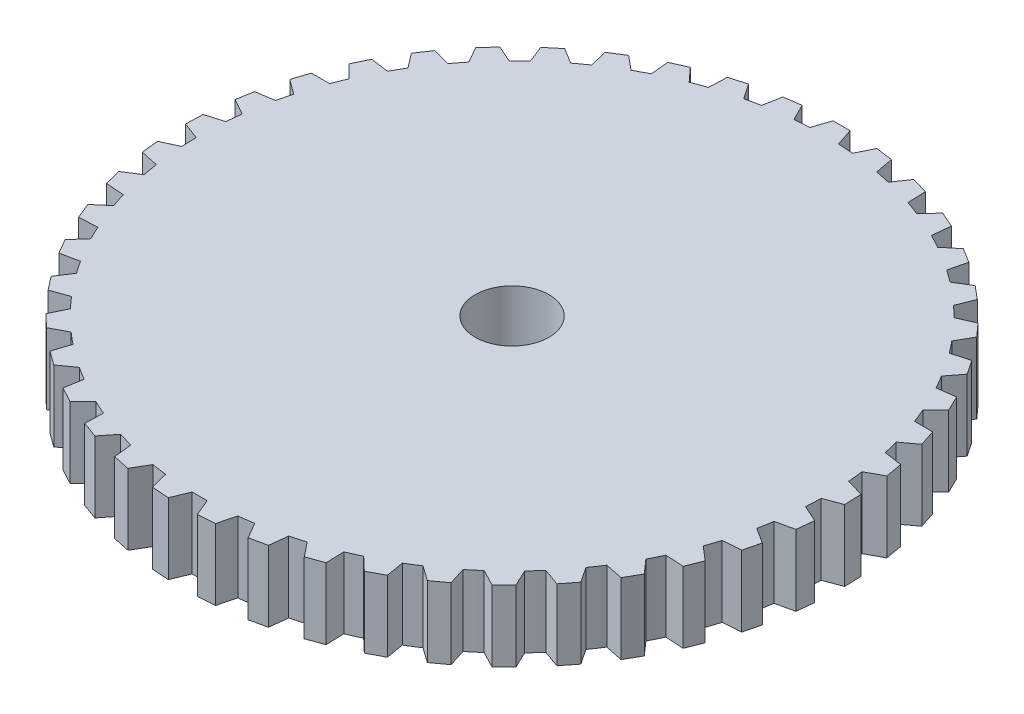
SolidWorks part; units mm, degrees
ref_plane "Front Plane" through (0, 0, 0) normal (0, 0, 1) x (1, 0, 0)
ref_plane "Top Plane" through (0, 0, 0) normal (0, 1, 0) x (1, 0, 0)
ref_plane "Right Plane" through (0, 0, 0) normal (1, 0, 0) x (0, 0, -1)
sketch "Sketch1" plane through (0, 0, 0) normal (0, 1, 0) x (1, 0, 0)
  circle A0 centre (0, 0) radius 13.97
extrude "Boss-Extrude1" add sketch "Sketch1" along normal blind 3.175
sketch "Sketch2" plane through (0, 3.175, 0) normal (0, 1, 0) x (1, 0, 0)
  line L0 (1.673, 14.6417) -> (2.4276, 14.5356)
  line L1 (-0.762, 13.589) -> (0.762, 13.589)
  line L2 (2.4276, 14.5356) -> (2.6458, 13.3507)
  line L3 (-0.381, 14.732) -> (0.381, 14.732)
  line L4 (0.381, 14.732) -> (0.762, 13.589)
  line L5 (-0.381, 14.732) -> (-0.762, 13.589)
  line L6 (1.1366, 13.5628) -> (2.6458, 13.3507)
  line L7 (1.673, 14.6417) -> (1.1366, 13.5628)
  line L8 (3.6944, 14.2663) -> (4.4269, 14.0563)
  line L9 (4.4269, 14.0563) -> (4.4781, 12.8525)
  line L10 (3.0132, 13.2726) -> (4.4781, 12.8525)
  line L11 (3.6944, 14.2663) -> (3.0132, 13.2726)
  line L12 (5.644, 13.6133) -> (6.3401, 13.3034)
  line L13 (6.3401, 13.3034) -> (6.2233, 12.1042)
  line L14 (4.831, 12.7241) -> (6.2233, 12.1042)
  line L15 (5.644, 13.6133) -> (4.831, 12.7241)
  line L16 (7.4837, 12.6953) -> (8.1299, 12.2915)
  line L17 (8.1299, 12.2915) -> (7.8473, 11.1203)
  line L18 (6.5549, 11.9279) -> (7.8473, 11.1203)
  line L19 (7.4837, 12.6953) -> (6.5549, 11.9279)
  line L20 (9.1777, 11.5303) -> (9.7614, 11.0405)
  line L21 (9.7614, 11.0405) -> (9.3186, 9.92)
  line L22 (8.1511, 10.8996) -> (9.3186, 9.92)
  line L23 (9.1777, 11.5303) -> (8.1511, 10.8996)
  line L24 (10.6931, 10.1408) -> (11.2029, 9.5745)
  line L25 (11.2029, 9.5745) -> (10.6085, 8.5265)
  line L26 (9.5887, 9.6591) -> (10.6085, 8.5265)
  line L27 (10.6931, 10.1408) -> (9.5887, 9.6591)
  line L28 (12.0003, 8.5539) -> (12.4264, 7.9222)
  line L29 (12.4264, 7.9222) -> (11.6919, 6.9671)
  line L30 (10.8397, 8.2306) -> (11.6919, 6.9671)
  line L31 (12.0003, 8.5539) -> (10.8397, 8.2306)
  line L32 (13.074, 6.8005) -> (13.4081, 6.1156)
  line L33 (13.4081, 6.1156) -> (12.5478, 5.2721)
  line L34 (11.8797, 6.6419) -> (12.5478, 5.2721)
  line L35 (13.074, 6.8005) -> (11.8797, 6.6419)
  line L36 (13.8932, 4.9148) -> (14.1287, 4.1901)
  line L37 (14.1287, 4.1901) -> (13.1594, 3.4745)
  line L38 (12.6884, 4.9239) -> (13.1594, 3.4745)
  line L39 (13.8932, 4.9148) -> (12.6884, 4.9239)
  line L40 (14.442, 2.9334) -> (14.5743, 2.183)
  line L41 (14.5743, 2.183) -> (13.5149, 1.6093)
  line L42 (13.2502, 3.1101) -> (13.5149, 1.6093)
  line L43 (14.442, 2.9334) -> (13.2502, 3.1101)
  line L44 (14.7097, 0.8949) -> (14.7363, 0.1334)
  line L45 (14.7363, 0.1334) -> (13.6073, -0.2873)
  line L46 (13.5541, 1.2358) -> (13.6073, -0.2873)
  line L47 (14.7097, 0.8949) -> (13.5541, 1.2358)
  line L48 (14.6911, -1.161) -> (14.6115, -1.9188)
  line L49 (14.6115, -1.9188) -> (13.4349, -2.1783)
  line L50 (13.5942, -0.6626) -> (13.4349, -2.1783)
  line L51 (14.6911, -1.161) -> (13.5942, -0.6626)
  line L52 (14.3866, -3.1943) -> (14.2022, -3.9337)
  line L53 (14.2022, -3.9337) -> (13.001, -4.0268)
  line L54 (13.3697, -2.5481) -> (13.001, -4.0268)
  line L55 (14.3866, -3.1943) -> (13.3697, -2.5481)
  line L56 (13.802, -5.1654) -> (13.5165, -5.872)
  line L57 (13.5165, -5.872) -> (12.3141, -5.797)
  line L58 (12.885, -4.384) -> (12.3141, -5.797)
  line L59 (13.802, -5.1654) -> (12.885, -4.384)
  line L60 (12.9488, -7.036) -> (12.5678, -7.696)
  line L61 (12.5678, -7.696) -> (11.3874, -7.4544)
  line L62 (12.1494, -6.1346) -> (11.3874, -7.4544)
  line L63 (12.9488, -7.036) -> (12.1494, -6.1346)
  line L64 (11.8435, -8.7697) -> (11.3744, -9.3702)
  line L65 (11.3744, -9.3702) -> (10.2391, -8.9667)
  line L66 (11.1774, -7.7658) -> (10.2391, -8.9667)
  line L67 (11.8435, -8.7697) -> (11.1774, -7.7658)
  line L68 (10.5078, -10.3326) -> (9.9596, -10.862)
  line L69 (9.9596, -10.862) -> (8.8916, -10.3044)
  line L70 (9.9878, -9.2458) -> (8.8916, -10.3044)
  line L71 (10.5078, -10.3326) -> (9.9878, -9.2458)
  line L72 (8.9675, -11.6945) -> (8.351, -12.1424)
  line L73 (8.351, -12.1424) -> (7.3709, -11.4416)
  line L74 (8.6039, -10.5458) -> (7.3709, -11.4416)
  line L75 (8.9675, -11.6945) -> (8.6039, -10.5458)
  line L76 (7.2527, -12.8287) -> (6.5799, -13.1865)
  line L77 (6.5799, -13.1865) -> (5.7068, -12.3561)
  line L78 (7.0525, -11.6406) -> (5.7068, -12.3561)
  line L79 (7.2527, -12.8287) -> (7.0525, -11.6406)
  line L80 (5.3967, -13.7132) -> (4.6806, -13.9739)
  line L81 (4.6806, -13.9739) -> (3.9317, -13.0301)
  line L82 (5.3638, -12.5089) -> (3.9317, -13.0301)
  line L83 (5.3967, -13.7132) -> (5.3638, -12.5089)
  line L84 (3.4356, -14.3309) -> (2.6903, -14.4893)
  line L85 (2.6903, -14.4893) -> (2.08, -13.4505)
  line L86 (3.5707, -13.1336) -> (2.08, -13.4505)
  line L87 (3.4356, -14.3309) -> (3.5707, -13.1336)
  line L88 (1.4077, -14.6695) -> (0.6476, -14.7227)
  line L89 (0.6476, -14.7227) -> (0.1878, -13.6091)
  line L90 (1.7081, -13.5027) -> (0.1878, -13.6091)
  line L91 (1.4077, -14.6695) -> (1.7081, -13.5027)
  line L92 (-0.6476, -14.7227) -> (-1.4077, -14.6695)
  line L93 (-1.4077, -14.6695) -> (-1.7081, -13.5027)
  line L94 (-0.1878, -13.6091) -> (-1.7081, -13.5027)
  line L95 (-0.6476, -14.7227) -> (-0.1878, -13.6091)
  line L96 (-2.6903, -14.4893) -> (-3.4356, -14.3309)
  line L97 (-3.4356, -14.3309) -> (-3.5707, -13.1336)
  line L98 (-2.08, -13.4505) -> (-3.5707, -13.1336)
  line L99 (-2.6903, -14.4893) -> (-2.08, -13.4505)
  line L100 (-4.6806, -13.9739) -> (-5.3967, -13.7132)
  line L101 (-5.3967, -13.7132) -> (-5.3638, -12.5089)
  line L102 (-3.9317, -13.0301) -> (-5.3638, -12.5089)
  line L103 (-4.6806, -13.9739) -> (-3.9317, -13.0301)
  line L104 (-6.5799, -13.1865) -> (-7.2527, -12.8287)
  line L105 (-7.2527, -12.8287) -> (-7.0525, -11.6406)
  line L106 (-5.7068, -12.3561) -> (-7.0525, -11.6406)
  line L107 (-6.5799, -13.1865) -> (-5.7068, -12.3561)
  line L108 (-8.351, -12.1424) -> (-8.9675, -11.6945)
  line L109 (-8.9675, -11.6945) -> (-8.6039, -10.5458)
  line L110 (-7.3709, -11.4416) -> (-8.6039, -10.5458)
  line L111 (-8.351, -12.1424) -> (-7.3709, -11.4416)
  line L112 (-9.9596, -10.862) -> (-10.5078, -10.3326)
  line L113 (-10.5078, -10.3326) -> (-9.9878, -9.2458)
  line L114 (-8.8916, -10.3044) -> (-9.9878, -9.2458)
  line L115 (-9.9596, -10.862) -> (-8.8916, -10.3044)
  line L116 (-11.3744, -9.3702) -> (-11.8435, -8.7697)
  line L117 (-11.8435, -8.7697) -> (-11.1774, -7.7658)
  line L118 (-10.2391, -8.9667) -> (-11.1774, -7.7658)
  line L119 (-11.3744, -9.3702) -> (-10.2391, -8.9667)
  line L120 (-12.5678, -7.696) -> (-12.9488, -7.036)
  line L121 (-12.9488, -7.036) -> (-12.1494, -6.1346)
  line L122 (-11.3874, -7.4544) -> (-12.1494, -6.1346)
  line L123 (-12.5678, -7.696) -> (-11.3874, -7.4544)
  line L124 (-13.5165, -5.872) -> (-13.802, -5.1654)
  line L125 (-13.802, -5.1654) -> (-12.885, -4.384)
  line L126 (-12.3141, -5.797) -> (-12.885, -4.384)
  line L127 (-13.5165, -5.872) -> (-12.3141, -5.797)
  line L128 (-14.2022, -3.9337) -> (-14.3866, -3.1943)
  line L129 (-14.3866, -3.1943) -> (-13.3697, -2.5481)
  line L130 (-13.001, -4.0268) -> (-13.3697, -2.5481)
  line L131 (-14.2022, -3.9337) -> (-13.001, -4.0268)
  line L132 (-14.6115, -1.9188) -> (-14.6911, -1.161)
  line L133 (-14.6911, -1.161) -> (-13.5942, -0.6626)
  line L134 (-13.4349, -2.1783) -> (-13.5942, -0.6626)
  line L135 (-14.6115, -1.9188) -> (-13.4349, -2.1783)
  line L136 (-14.7363, 0.1334) -> (-14.7097, 0.8949)
  line L137 (-14.7097, 0.8949) -> (-13.5541, 1.2358)
  line L138 (-13.6073, -0.2873) -> (-13.5541, 1.2358)
  line L139 (-14.7363, 0.1334) -> (-13.6073, -0.2873)
  line L140 (-14.5743, 2.183) -> (-14.442, 2.9334)
  line L141 (-14.442, 2.9334) -> (-13.2502, 3.1101)
  line L142 (-13.5149, 1.6093) -> (-13.2502, 3.1101)
  line L143 (-14.5743, 2.183) -> (-13.5149, 1.6093)
  line L144 (-14.1287, 4.1901) -> (-13.8932, 4.9148)
  line L145 (-13.8932, 4.9148) -> (-12.6884, 4.9239)
  line L146 (-13.1594, 3.4745) -> (-12.6884, 4.9239)
  line L147 (-14.1287, 4.1901) -> (-13.1594, 3.4745)
  line L148 (-13.4081, 6.1156) -> (-13.074, 6.8005)
  line L149 (-13.074, 6.8005) -> (-11.8797, 6.6419)
  line L150 (-12.5478, 5.2721) -> (-11.8797, 6.6419)
  line L151 (-13.4081, 6.1156) -> (-12.5478, 5.2721)
  line L152 (-12.4264, 7.9222) -> (-12.0003, 8.5539)
  line L153 (-12.0003, 8.5539) -> (-10.8397, 8.2306)
  line L154 (-11.6919, 6.9671) -> (-10.8397, 8.2306)
  line L155 (-12.4264, 7.9222) -> (-11.6919, 6.9671)
  line L156 (-11.2029, 9.5745) -> (-10.6931, 10.1408)
  line L157 (-10.6931, 10.1408) -> (-9.5887, 9.6591)
  line L158 (-10.6085, 8.5265) -> (-9.5887, 9.6591)
  line L159 (-11.2029, 9.5745) -> (-10.6085, 8.5265)
  line L160 (-9.7614, 11.0405) -> (-9.1777, 11.5303)
  line L161 (-9.1777, 11.5303) -> (-8.1511, 10.8996)
  line L162 (-9.3186, 9.92) -> (-8.1511, 10.8996)
  line L163 (-9.7614, 11.0405) -> (-9.3186, 9.92)
  line L164 (-8.1299, 12.2915) -> (-7.4837, 12.6953)
  line L165 (-7.4837, 12.6953) -> (-6.5549, 11.9279)
  line L166 (-7.8473, 11.1203) -> (-6.5549, 11.9279)
  line L167 (-8.1299, 12.2915) -> (-7.8473, 11.1203)
  line L168 (-6.3401, 13.3034) -> (-5.644, 13.6133)
  line L169 (-5.644, 13.6133) -> (-4.831, 12.7241)
  line L170 (-6.2233, 12.1042) -> (-4.831, 12.7241)
  line L171 (-6.3401, 13.3034) -> (-6.2233, 12.1042)
  line L172 (-4.4269, 14.0563) -> (-3.6944, 14.2663)
  line L173 (-3.6944, 14.2663) -> (-3.0132, 13.2726)
  line L174 (-4.4781, 12.8525) -> (-3.0132, 13.2726)
  line L175 (-4.4269, 14.0563) -> (-4.4781, 12.8525)
  line L176 (-2.4276, 14.5356) -> (-1.673, 14.6417)
  line L177 (-1.673, 14.6417) -> (-1.1366, 13.5628)
  line L178 (-2.6458, 13.3507) -> (-1.1366, 13.5628)
  line L179 (-2.4276, 14.5356) -> (-2.6458, 13.3507)
extrude "Boss-Extrude2" add sketch "Sketch2" against normal blind 3.175
sketch "Sketch3" plane through (0, 3.175, 0) normal (0, 1, 0) x (1, 0, 0)
  circle A0 centre (0, 0) radius 1.651
extrude "Cut-Extrude1" cut sketch "Sketch3" against normal blind 3.175
